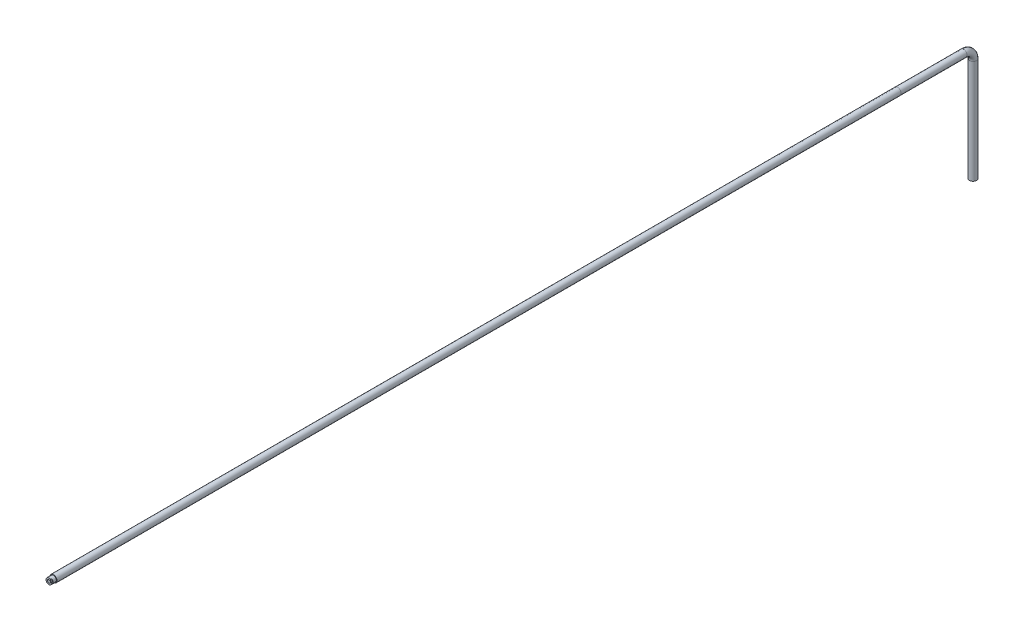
SolidWorks part; units mm, degrees
ref_plane "Front" through (0, 0, 0) normal (0, 0, 1) x (1, 0, 0)
ref_plane "Top" through (0, 0, 0) normal (0, 1, 0) x (1, 0, 0)
ref_plane "Right" through (0, 0, 0) normal (1, 0, 0) x (0, 0, -1)
sketch "PATH" plane through (0, 0, 0) normal (1, 0, 0) x (0, 0, -1)
  line L0 (0, 0) -> (615.95, 0)
  line L1 (622.3, -6.35) -> (622.3, -76.2)
  arc A0 (615.95, 0) -> (622.3, -6.35) centre (615.95, -6.35) cw
  point P6 (622.3, 0)
  dimension "D2" = 6.35
  dimension "D1" = 76.2
  dimension "D3" = 622.3
sketch "Sketch2" plane through (0, 0, 0) normal (0, 0, 1) x (1, 0, 0)
  circle A0 centre (0, 0) radius 2.3813
  dimension "D1" = 4.7625
sweep "Sweep1" add profiles "Sketch2" path "PATH"
sketch "Sketch3" plane through (0, 0, 0) normal (1, 0, 0) x (0, 0, -1)
  line L0 (615.95, 2.3813) -> (0, 2.3813) construction
  line L1 (-2.6407, -1.5875) -> (3.048, -1.5875)
  line L2 (-2.6407, -1.5875) -> (-2.6407, -4.6728)
  line L3 (-2.6407, -4.6728) -> (3.048, -4.6728)
  line L4 (3.048, -1.5875) -> (3.048, -4.6728)
  line L5 (0, 2.3813) -> (0, -2.3813) construction
  dimension "D1" = 3.9688
  dimension "D2" = 3.048
extrude "Cut-Extrude1" [suppressed] cut sketch "Sketch3" against normal mid plane 9.2075
hole_wizard "#3-48 Tapped Hole1" positions "Sketch5" profile "Sketch6" tap size "#3-48" standard "Ansi Inch"
sketch "Sketch5" plane through (0, 0, 0) normal (0, 0, 1) x (1, 0, 0)
  point P0 (0, 0)
sketch "Sketch6" plane through (0, 0, 0) normal (1, 0, 0) x (0, -1, 0)
  line L0 (0, 0) -> (0, 8.2698)
  line L1 (0, 8.2698) -> (0.9969, 7.6708)
  line L2 (0.9969, 7.6708) -> (0.9969, 0)
  line L5 (0.9969, 0) -> (0, 0)
  line L10 (0, 8.2698) -> (-0.997, 7.6708) construction
  line L11 (0, -6.35) -> (0, 107.95) construction
  dimension "Tap Drill Dia." = 1.9939
  dimension "Tap Drill Depth" = 7.6708
  dimension "Drill Angle" = 118
sketch "Sketch7" plane through (0, 0, 0) normal (0, 0, 1) x (1, 0, 0)
  circle A0 centre (0, 0) radius 1.9685
  circle A1 centre (0, 0) radius 2.3813 construction
  dimension "D1" = 3.937
extrude "Cut-Extrude2" cut sketch "Sketch7" against normal blind 3.048 flip side to cut
sketch "Sketch8" plane through (0, 0, 0) normal (0, 0, 1) x (1, 0, 0)
  line L0 (0.4309, 3.0366) -> (2.5179, -1.8509)
  line L1 (0.4309, 3.0366) -> (1.1586, 2.7957)
  line L2 (1.1586, 2.7957) -> (2.7879, -1.1747)
  line L3 (2.7879, -1.1747) -> (2.5179, -1.8509)
extrude "Cut-Extrude3" cut sketch "Sketch8" against normal blind 0.7925
ref_plane "Plane1" through (0, 0, -571.5) normal (0, 0, 1) x (1, 0, 0)
sketch "Sketch9" plane through (0, 0, -571.5) normal (0, 0, 1) x (1, 0, 0)
  circle A0 centre (0, 0) radius 2.3495
  dimension "D1" = 4.699
extrude "Cut-Extrude4" cut sketch "Sketch9" against normal blind 44.45 flip side to cut
